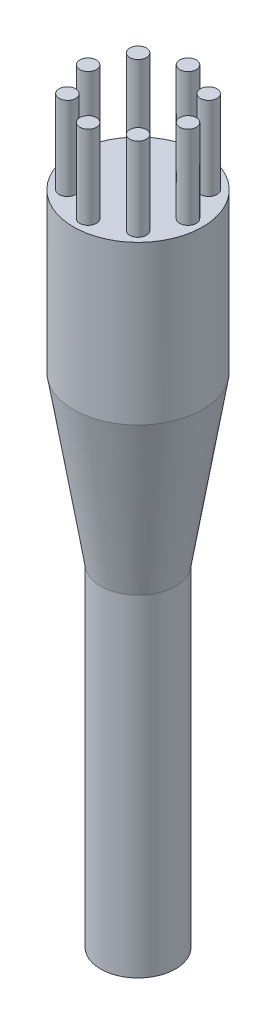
SolidWorks part; units mm, degrees
ref_plane "Front" through (0, 0, 0) normal (0, 0, 1) x (1, 0, 0)
ref_plane "Top" through (0, 0, 0) normal (0, 1, 0) x (1, 0, 0)
ref_plane "Right" through (0, 0, 0) normal (1, 0, 0) x (0, 0, -1)
sketch "Sketch1" plane through (0, 0, 0) normal (1, 0, 0) x (0, 0, -1)
  line L0 (0, 73.4979) -> (0, -93.4936) construction
sketch "Sketch2" plane through (0, 0, 0) normal (0, 1, 0) x (1, 0, 0)
  circle A0 centre (0, 0) radius 7.75
  dimension "D1" = 15.5
extrude "Extrude1" add sketch "Sketch2" along normal blind 19
sketch "Sketch5" plane through (0, 19, 0) normal (0, 1, 0) x (-1, 0, 0)
  line L0 (0, 0) -> (0, -13.6278) construction
  circle A0 centre (0, -6) radius 1
  circle A1 centre (0, 0) radius 6 construction
  dimension "D1" = 12
  dimension "D2" = 2
extrude "Extrude4" add sketch "Sketch5" along normal blind 10
pattern_circular "CirPattern1" count 8 over 360 about axis through (0, 0, 0) along (0, 1, 0) of "Extrude4"
sketch "Sketch6" plane through (0, 19, 0) normal (0, 1, 0) x (-1, 0, 0)
  line L0 (0, -6) -> (6, 0) construction
  line L1 (0, 0) -> (3, -3) construction
  circle A0 centre (1.5, -1.5) radius 1
  circle A1 centre (0, -6) radius 1 construction
extrude "Extrude5" [suppressed] add sketch "Sketch6" along normal blind 10
sketch "Sketch7" plane through (0, 0, 0) normal (1, 0, 0) x (0, 0, -1)
  line L0 (-7.75, 19) -> (-7.75, 0) construction
  line L1 (-7.75, 0) -> (7.75, 0) construction
  line L2 (-7.75, 0) -> (-4.5, -20)
  line L4 (-4.5, -20) -> (-4.5, -59.8168)
  line L5 (-4.5, -59.8168) -> (0, -59.8168)
  line L6 (0, 73.4979) -> (0, -93.4936) construction
  line L7 (-7.75, 0) -> (0, 0)
  line L8 (0, 0) -> (0, -59.8168)
  dimension "D1" = 4.5
  dimension "D2" = 20
revolve "Revolve1" add sketch "Sketch7" angle 360 about L0
